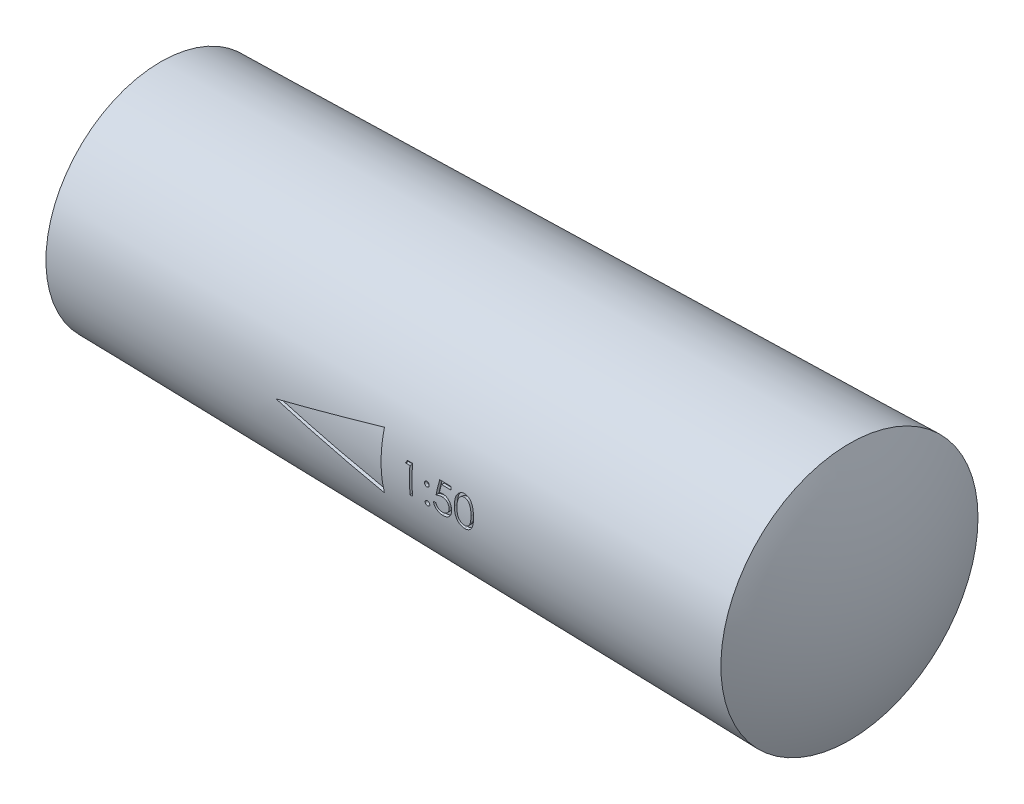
SolidWorks part; units mm, degrees
ref_plane "Front Plane" through (0, 0, 0) normal (0, 0, 1) x (1, 0, 0)
ref_plane "Top Plane" through (0, 0, 0) normal (0, 1, 0) x (1, 0, 0)
ref_plane "Right Plane" through (0, 0, 0) normal (1, 0, 0) x (0, 0, -1)
sketch "Sketch1" plane through (0, 0, 0) normal (1, 0, 0) x (0, 0, -1)
  circle A0 centre (0, 0) radius 4
  dimension "D1" = 8
extrude "Extrude1" add sketch "Sketch1" along normal mid plane 24
draft "Draft1" type of draft neutral plane draft angle 1.146 faces to draft 1 parameters "D1"=1.146
sketch "Sketch2" plane through (0, 0, 0) normal (0, 0, 1) x (1, 0, 0)
  line L0 (-12, 0) -> (-12, 4)
  line L1 (-12, 4) -> (-12, -4) construction
  line L2 (-12, 0) -> (-13, 0)
  line L3 (-13, 0) -> (-13, -4.24) construction
  line L4 (12, 0) -> (12, 4.48)
  line L5 (12, -4.48) -> (12, 4.48) construction
  line L6 (12, 0) -> (13, 0)
  line L7 (13, 0) -> (13, -4.24) construction
  line L8 (-12, -4) -> (12, -4.48) construction
  arc A0 (-13, 0) -> (-12, 4) centre (-4.5, 0) cw
  arc A1 (13, 0) -> (12, 4.48) centre (2.4647, 0) ccw
  point P14 (0, -4.24)
revolve "Revolve1" add sketch "Sketch2" angle 360 about L2
sketch "Sketch5" plane through (0, 0, 0) normal (0, 0, 1) x (1, 0, 0)
  line L0 (0, 4.24) -> (0, -4.24) construction
  line L1 (12, 4.48) -> (-12, 4) construction
  line L2 (-12, -4) -> (12, -4.48) construction
ref_plane "Plane2" through (0, 0, 0) normal (-0.02, 0, 0.9998) x (0.9998, 0, 0.02)
sketch "Sketch6" plane through (0, 0, 0) normal (-0.02, 0, 0.9998) x (0.9998, 0, 0.02)
  line L0 (0, 0) -> (0, 1)
  line L1 (0, 4.24) -> (0, -4.24) construction
  line L2 (0, 1) -> (-3.7321, 0)
  line L3 (-3.7321, 0) -> (0, -1)
  line L4 (0, -1) -> (0, 0)
  line L5 (0, -0.5) -> (4, -0.5) construction
  text T0 "1:50" font "Century Gothic" height 1
  dimension "D1" = 2
  dimension "D2" = 30
  dimension "D3" = 4
wrap "Wrap2" sketch "Sketch6" wrap type deboss source sketch "Sketch6" thickness 0.1 parameters "D1"=0.1
equation "\"D2@Sketch2\" = \"D1@Sketch2\""
